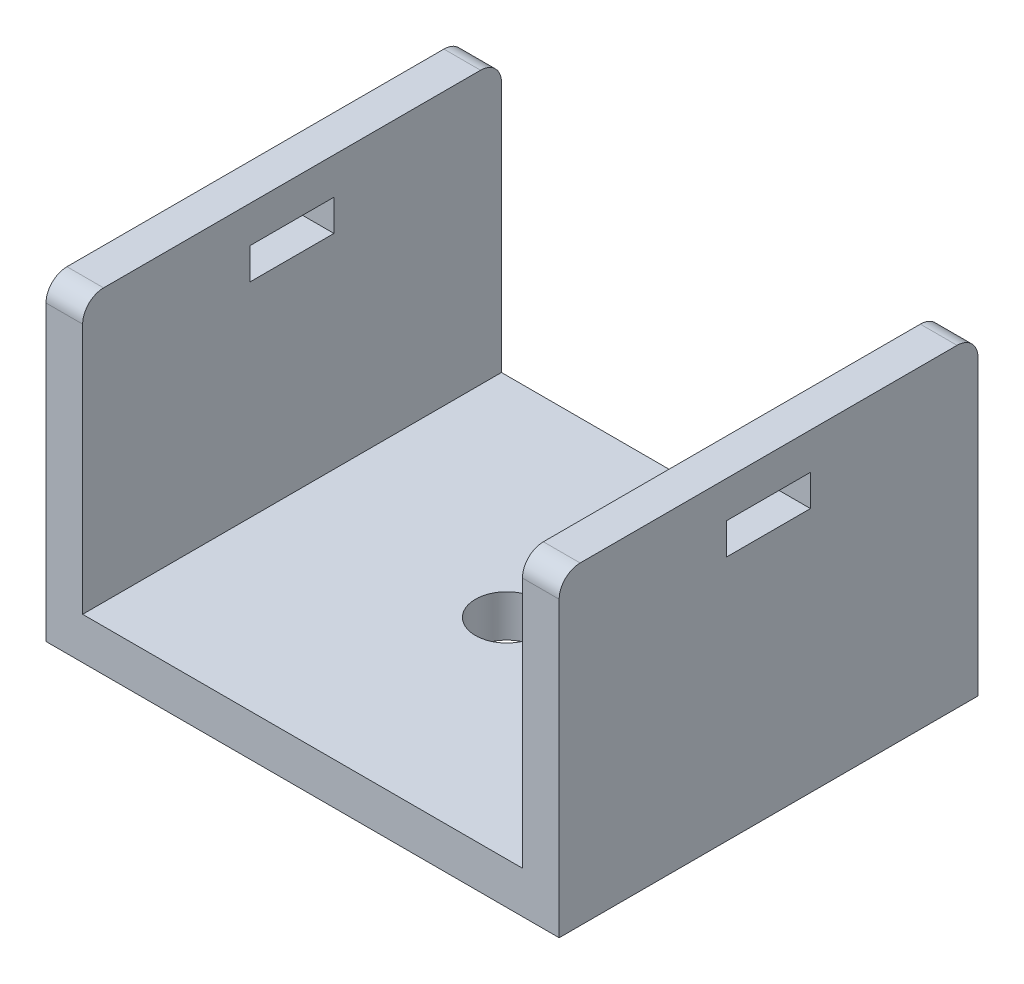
SolidWorks part; units mm, degrees
ref_plane "Plan de face" through (0, 0, 0) normal (0, 0, 1) x (1, 0, 0)
ref_plane "Plan de dessus" through (0, 0, 0) normal (0, 1, 0) x (1, 0, 0)
ref_plane "Plan de droite" through (0, 0, 0) normal (1, 0, 0) x (0, 0, -1)
sketch "Esquisse1" plane through (0, 0, 0) normal (0, 0, 1) x (1, 0, 0)
  line L0 (0, 0) -> (0, 15)
  line L1 (0, 15) -> (1.75, 15)
  line L2 (1.75, 15) -> (1.75, 2)
  line L3 (1.75, 2) -> (22.75, 2)
  line L4 (22.75, 2) -> (22.75, 15)
  line L5 (22.75, 15) -> (24.5038, 15)
  line L6 (24.5038, 15) -> (24.5038, 0)
  line L7 (24.5038, 0) -> (0, 0)
  dimension "D1" = 15
  dimension "D2" = 21
  dimension "D3" = 15
  dimension "D4" = 1.75
  dimension "D5" = 1.7538
  dimension "D6" = 2
extrude "Boss.-Extru.1" add sketch "Esquisse1" along normal blind 20
sketch "Esquisse2" plane through (24.5038, 0, 0) normal (1, 0, 0) x (0, 0, -1)
  line L0 (0, 0) -> (0, 15) construction
  line L1 (-12, 13.25) -> (-8, 13.25)
  line L2 (-12, 13.25) -> (-12, 11.75)
  line L3 (-12, 11.75) -> (-8, 11.75)
  line L4 (-8, 13.25) -> (-8, 11.75)
  line L5 (-20, 15) -> (0, 15) construction
  dimension "D1" = 4
  dimension "D2" = 1.5
  dimension "D3" = 8
  dimension "D4" = 1.75
extrude "Enlèv. mat.-Extru.1" cut sketch "Esquisse2" against normal blind 30
sketch "Esquisse3" plane through (0, 0, 0) normal (0, -1, 0) x (1, 0, 0)
  line L0 (24.5038, 20) -> (24.5038, 0) construction
  line L1 (0, 20) -> (24.5038, 20) construction
  circle A0 centre (12.0038, 10) radius 1.5
  dimension "D1" = 3
  dimension "D2" = 12.5
  dimension "D3" = 10
extrude "Enlèv. mat.-Extru.2" cut sketch "Esquisse3" against normal blind 10
fillet "Congé1" radius 1 4 edges at (23.6269, 15, 20) (23.6269, 15, 0) (0.875, 15, 0) (0.875, 15, 20)
